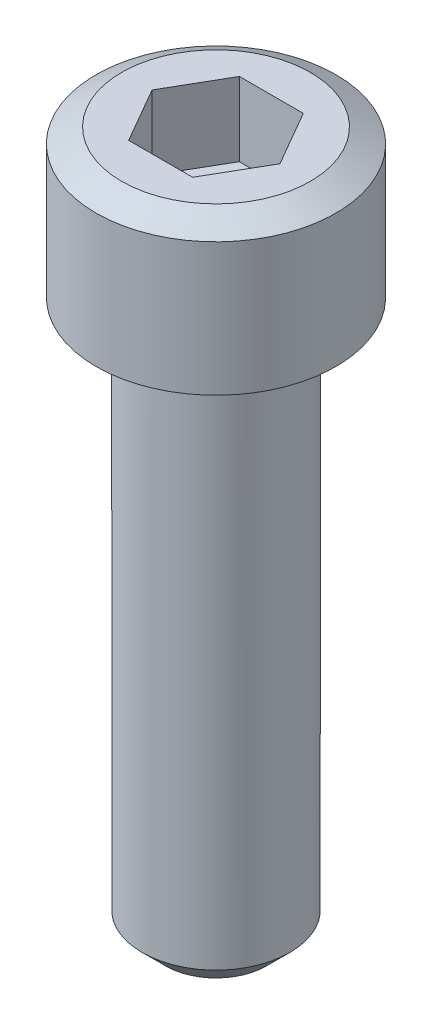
SolidWorks part; units mm, degrees
ref_plane "正面" through (0, 0, 0) normal (0, 0, 1) x (1, 0, 0)
ref_plane "平面" through (0, 0, 0) normal (0, 1, 0) x (1, 0, 0)
ref_plane "右側面" through (0, 0, 0) normal (1, 0, 0) x (0, 0, -1)
sketch "ｽｹｯﾁ1" plane through (0, 0, 0) normal (0, 1, 0) x (1, 0, 0)
  circle A0 centre (0, 0) radius 6.5
  dimension "D1" = 13
extrude "押し出し1" add sketch "ｽｹｯﾁ1" along normal blind 8
sketch "ｽｹｯﾁ2" plane through (0, 8, 0) normal (0, 1, 0) x (-1, 0, 0)
  line L1 (-3.4641, 0) -> (-1.7321, -3)
  line L2 (-1.7321, -3) -> (1.7321, -3)
  line L3 (1.7321, -3) -> (3.4641, 0)
  line L4 (3.4641, 0) -> (1.7321, 3)
  line L5 (1.7321, 3) -> (-1.7321, 3)
  line L6 (-1.7321, 3) -> (-3.4641, 0)
  circle A0 centre (0, 0) radius 3 construction
  dimension "D1" = 6
extrude "ｶｯﾄ - 押し出し1" cut sketch "ｽｹｯﾁ2" against normal blind 4
chamfer "面取り1" distance 0.8 angle 60 1 edges at (0, 8, 6.5)
sketch "ｽｹｯﾁ3" plane through (0, 0, 0) normal (0, -1, 0) x (1, 0, 0)
  circle A0 centre (0, 0) radius 4
  dimension "D1" = 8
extrude "押し出し2" add sketch "ｽｹｯﾁ3" along normal blind 30
chamfer "面取り2" distance 1.25 angle 45 1 edges at (0, -30, -4)
